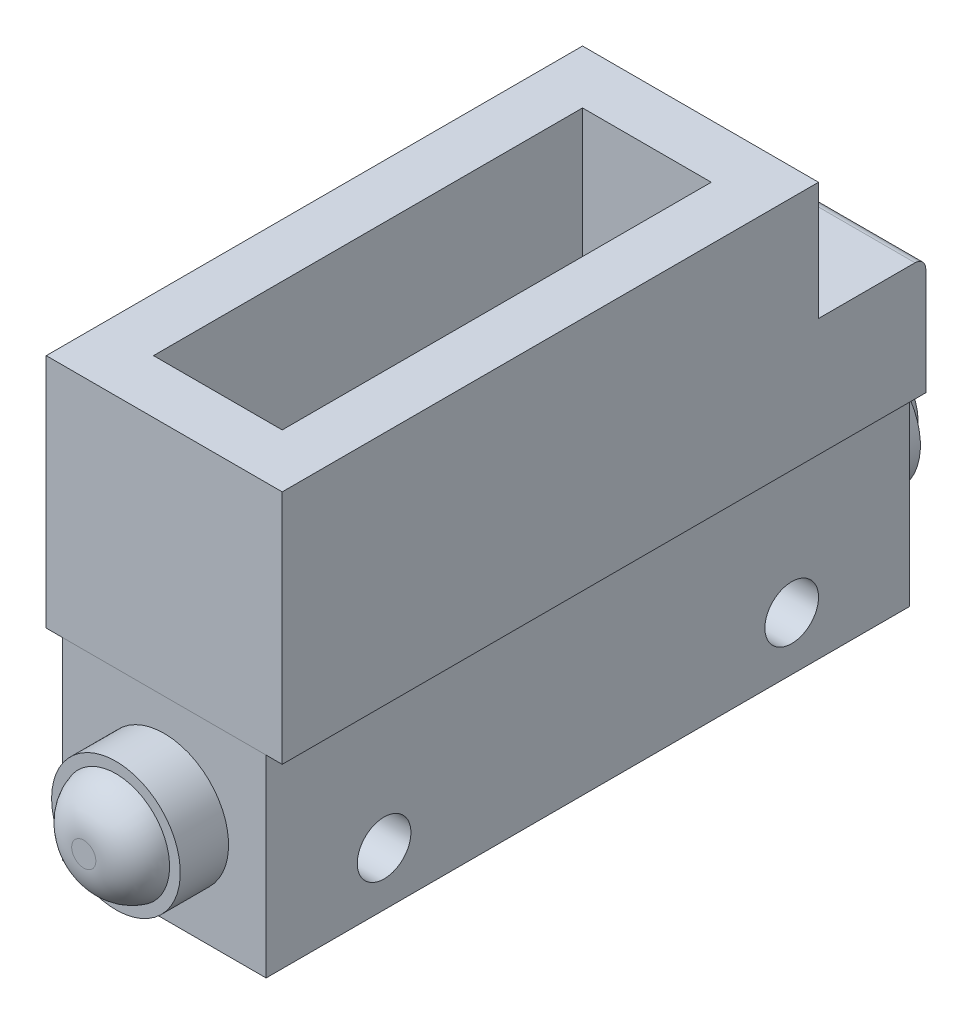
SolidWorks part; units mm, degrees
ref_plane "Front Plane" through (0, 0, 0) normal (0, 0, 1) x (1, 0, 0)
ref_plane "Top Plane" through (0, 0, 0) normal (0, 1, 0) x (1, 0, 0)
ref_plane "Right Plane" through (0, 0, 0) normal (1, 0, 0) x (0, 0, -1)
sketch "Sketch1" plane through (0, 0, 0) normal (1, 0, 0) x (0, 0, -1)
  line L1 (0, 0) -> (50, 0)
  line L2 (0, 0) -> (0, 22)
  line L3 (0, 22) -> (50, 22)
  line L4 (50, 11) -> (50, 22)
  line L5 (50, 0) -> (60, 0)
  line L7 (50, 11) -> (59, 11)
  line L8 (60, 0) -> (60, 10)
  arc A0 (59, 11) -> (60, 10) centre (59, 10) cw
  dimension "D1" = 1
extrude "Boss-Extrude1" add sketch "Sketch1" along normal mid plane 22
sketch "Sketch2" plane through (0, 22, 0) normal (0, 1, 0) x (1, 0, 0)
  line L8 (-6, 45) -> (-6, 5)
  line L9 (-6, 5) -> (6, 5)
  line L10 (6, 5) -> (6, 45)
  line L11 (6, 45) -> (-6, 45)
  line L12 (-6, 45) -> (-6, 5)
  line L13 (-6, 5) -> (6, 5)
  line L14 (6, 5) -> (6, 45)
  line L15 (6, 45) -> (-6, 45)
  dimension "D1" = 5
extrude "Cut-Extrude1" cut sketch "Sketch2" against normal through all
sketch "Sketch3" plane through (0, 0, 0) normal (1, 0, 0) x (0, 0, -1)
  line L0 (0, 0) -> (0, -13) construction
  line L1 (0, 0) -> (60, 0)
  line L2 (0, 0) -> (0, -18)
  line L3 (0, -18) -> (60, -18)
  line L4 (60, 0) -> (60, -18)
  line L5 (0, -13) -> (11, -13) construction
  line L6 (60, 0) -> (60, -13) construction
  line L7 (60, -13) -> (49, -13) construction
  circle A0 centre (11, -13) radius 2.5
  circle A1 centre (49, -13) radius 2.5
extrude "Boss-Extrude2" add sketch "Sketch3" along normal mid plane 19 separate body
sketch "Sketch4" plane through (0, 0, -60) normal (0, 0, -1) x (-1, 0, 0)
  circle A0 centre (0, -9) radius 6
extrude "Boss-Extrude3" add sketch "Sketch4" along normal blind 4.5 separate body
sketch "Sketch5" plane through (0, 0, -64.5) normal (0, 0, -1) x (-1, 0, 0)
  circle A0 centre (0, -9) radius 5
extrude "Boss-Extrude4" add sketch "Sketch5" along normal blind 3 separate body
fillet "Fillet1" radius 4 1 edges at (-5, -9, -67.5)
ref_plane "Plane1" through (0, 0, -30) normal (0, 0, 1) x (1, 0, 0)
mirror "Mirror1" about plane through (0, 0, -30) normal (0, 0, 1)
sketch "Sketch6" plane through (0, 0, 0) normal (1, 0, 0) x (0, 0, -1)
  line L0 (30, -13) -> (30, -20) construction
  circle A0 centre (11, -13) radius 2
  circle A1 centre (49, -13) radius 2
